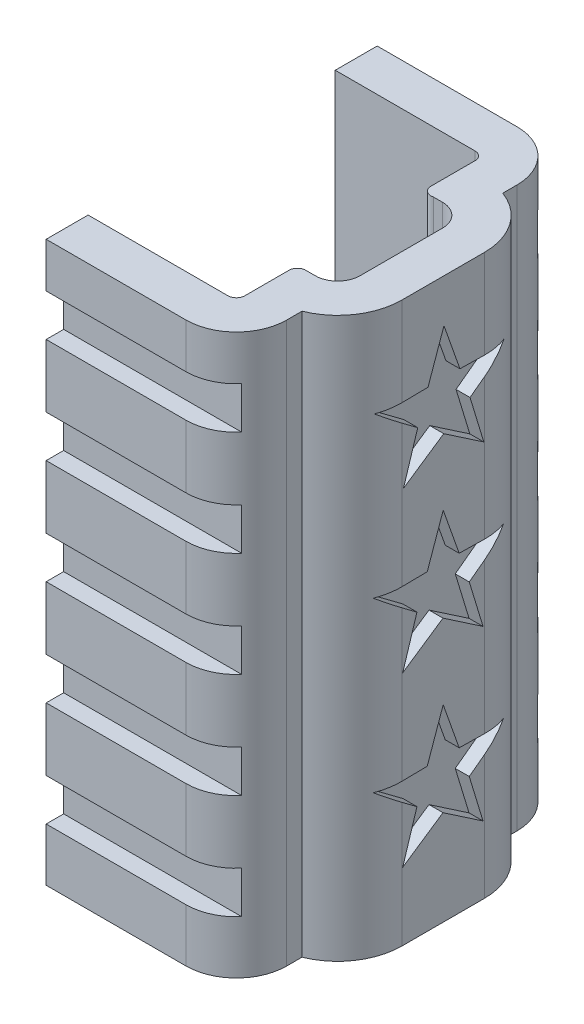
SolidWorks part; units mm, degrees
ref_plane "Front Plane" through (0, 0, 0) normal (0, 0, 1) x (1, 0, 0)
ref_plane "Top Plane" through (0, 0, 0) normal (0, 1, 0) x (1, 0, 0)
ref_plane "Right Plane" through (0, 0, 0) normal (1, 0, 0) x (0, 0, -1)
sketch "Sketch1" plane through (0, 0, 0) normal (0, 1, 0) x (1, 0, 0)
  line L0 (-69.609, 11.4133) -> (-56.909, 11.4133)
  line L1 (-56.147, 10.6513) -> (-56.147, 6.6372)
  line L2 (-55.183, 5.9024) -> (-54.3544, 5.9024)
  line L3 (-52.3224, 3.8704) -> (-52.3224, -3.6226)
  line L4 (-54.3544, -5.6546) -> (-55.218, -5.6546)
  line L5 (-55.98, -6.4166) -> (-55.98, -10.4307)
  line L6 (-56.742, -11.1927) -> (-69.442, -11.1927)
  line L7 (-69.609, 15.2233) -> (-56.909, 15.2233)
  line L8 (-52.337, 10.6513) -> (-52.337, 9.3531)
  line L9 (-52.337, 9.3531) -> (-52.337, 9.3531)
  line L10 (-48.5124, 3.8704) -> (-48.5124, -3.6226)
  line L11 (-52.17, -9.0408) -> (-52.17, -9.0408)
  line L12 (-52.17, -9.0408) -> (-52.17, -10.4307)
  line L13 (-56.742, -15.0027) -> (-69.442, -15.0027)
  line L14 (-69.609, 15.2233) -> (-69.609, 11.4133)
  line L15 (-69.442, -11.1927) -> (-69.442, -15.0027)
  arc A0 (-56.909, 11.4133) -> (-56.147, 10.6513) centre (-56.909, 10.6513) cw
  arc A1 (-56.147, 6.6372) -> (-55.183, 5.9024) centre (-55.385, 6.6372) ccw
  arc A2 (-54.3544, 5.9024) -> (-52.3224, 3.8704) centre (-54.3544, 3.8704) cw
  arc A3 (-52.3224, -3.6226) -> (-54.3544, -5.6546) centre (-54.3544, -3.6226) cw
  arc A4 (-55.218, -5.6546) -> (-55.98, -6.4166) centre (-55.218, -6.4166) ccw
  arc A5 (-55.98, -10.4307) -> (-56.742, -11.1927) centre (-56.742, -10.4307) cw
  arc A6 (-56.909, 15.2233) -> (-52.337, 10.6513) centre (-56.909, 10.6513) cw
  arc A7 (-52.337, 9.3531) -> (-52.337, 9.3531) centre (-52.337, 9.3531) ccw
  arc A8 (-52.337, 9.3531) -> (-48.5124, 3.8704) centre (-54.3544, 3.8704) cw
  arc A9 (-48.5124, -3.6226) -> (-52.17, -9.0408) centre (-54.3544, -3.6226) cw
  arc A10 (-52.17, -9.0408) -> (-52.17, -9.0408) centre (-52.17, -9.0408) ccw
  arc A11 (-52.17, -10.4307) -> (-56.742, -15.0027) centre (-56.742, -10.4307) cw
  dimension "D4" = 0.762
  dimension "D5" = 3.81
  dimension "D7" = 2.032
  dimension "D8" = 0.762
  dimension "D1" = 11.557
  dimension "D2" = 22.606
  dimension "D3" = 12.7
extrude "Boss-Extrude1" add sketch "Sketch1" along normal blind 50.8
ref_plane "Plane1" through (0, 0, -0.1103) normal (0, 0, -1) x (-1, 0, 0)
sketch "Sketch5" plane through (0, 0, 15.0027) normal (0, 0, 1) x (1, 0, 0)
  line L0 (-71.7998, 44.8264) -> (-50.0279, 44.8264) construction
  line L1 (-71.7998, 46.7314) -> (-50.0279, 46.7314)
  line L2 (-71.7998, 42.9214) -> (-50.0279, 42.9214)
  line L3 (-71.7998, 35.3014) -> (-50.0279, 35.3014) construction
  line L4 (-71.7998, 37.2064) -> (-50.0279, 37.2064)
  line L5 (-71.7998, 33.3964) -> (-50.0279, 33.3964)
  line L6 (-71.7998, 25.7764) -> (-50.0279, 25.7764) construction
  line L7 (-71.7998, 27.6814) -> (-50.0279, 27.6814)
  line L8 (-71.7998, 23.8714) -> (-50.0279, 23.8714)
  line L9 (-71.7998, 16.2514) -> (-50.0279, 16.2514) construction
  line L10 (-71.7998, 18.1564) -> (-50.0279, 18.1564)
  line L11 (-71.7998, 14.3464) -> (-50.0279, 14.3464)
  line L12 (-71.7998, 6.7264) -> (-50.0279, 6.7264) construction
  line L13 (-71.7998, 8.6314) -> (-50.0279, 8.6314)
  line L14 (-71.7998, 4.8214) -> (-50.0279, 4.8214)
  arc A0 (-71.7998, 46.7314) -> (-71.7998, 42.9214) centre (-71.7998, 44.8264) ccw
  arc A1 (-50.0279, 42.9214) -> (-50.0279, 46.7314) centre (-50.0279, 44.8264) ccw
  arc A2 (-71.7998, 37.2064) -> (-71.7998, 33.3964) centre (-71.7998, 35.3014) ccw
  arc A3 (-50.0279, 33.3964) -> (-50.0279, 37.2064) centre (-50.0279, 35.3014) ccw
  arc A4 (-71.7998, 27.6814) -> (-71.7998, 23.8714) centre (-71.7998, 25.7764) ccw
  arc A5 (-50.0279, 23.8714) -> (-50.0279, 27.6814) centre (-50.0279, 25.7764) ccw
  arc A6 (-71.7998, 18.1564) -> (-71.7998, 14.3464) centre (-71.7998, 16.2514) ccw
  arc A7 (-50.0279, 14.3464) -> (-50.0279, 18.1564) centre (-50.0279, 16.2514) ccw
  arc A8 (-71.7998, 8.6314) -> (-71.7998, 4.8214) centre (-71.7998, 6.7264) ccw
  arc A9 (-50.0279, 4.8214) -> (-50.0279, 8.6314) centre (-50.0279, 6.7264) ccw
  point P2 (-60.9139, 44.8264)
  point P7 (-60.9139, 35.3014)
  point P14 (-60.9139, 25.7764)
  point P21 (-60.9139, 16.2514)
  point P28 (-60.9139, 6.7264)
extrude "Cut-Extrude1" cut sketch "Sketch5" against normal blind 1.5875
mirror "Mirror1" about plane through (0, 0, -0.1103) normal (0, 0, -1) of "Cut-Extrude1"
sketch "Sketch6" plane through (-48.5124, 0, 0) normal (1, 0, 0) x (0, 0, -1)
  line L0 (0.1888, 46.8708) -> (1.641, 42.7573)
  line L1 (1.641, 42.7573) -> (6.095, 42.6759)
  line L2 (6.095, 42.6759) -> (2.5548, 40.0462)
  line L3 (2.5548, 40.0462) -> (3.807, 35.9206)
  line L4 (3.807, 35.9206) -> (0.1686, 38.3916)
  line L5 (0.1686, 38.3916) -> (-3.4872, 35.9206)
  line L6 (-3.4872, 35.9206) -> (-2.192, 40.0462)
  line L7 (-2.192, 40.0462) -> (-5.7348, 42.6952)
  line L8 (-5.7348, 42.6952) -> (-1.2603, 42.7573)
  line L9 (-1.2603, 42.7573) -> (0.1888, 46.8708)
  line L10 (0.1196, 32.3992) -> (1.5718, 28.2858)
  line L11 (1.5718, 28.2858) -> (6.0259, 28.2044)
  line L12 (6.0259, 28.2044) -> (2.4856, 25.5747)
  line L13 (2.4856, 25.5747) -> (3.7379, 21.4491)
  line L14 (3.7379, 21.4491) -> (0.0994, 23.9201)
  line L15 (0.0994, 23.9201) -> (-3.5564, 21.4491)
  line L16 (-3.5564, 21.4491) -> (-2.2612, 25.5747)
  line L17 (-2.2612, 25.5747) -> (-5.804, 28.2236)
  line L18 (-5.804, 28.2236) -> (-1.3295, 28.2858)
  line L19 (-1.3295, 28.2858) -> (0.1196, 32.3992)
  line L20 (0.1179, 17.1028) -> (1.5702, 12.9894)
  line L21 (1.5702, 12.9894) -> (6.0242, 12.9079)
  line L22 (6.0242, 12.9079) -> (2.4839, 10.2782)
  line L23 (2.4839, 10.2782) -> (3.7362, 6.1527)
  line L24 (3.7362, 6.1527) -> (0.0977, 8.6237)
  line L25 (0.0977, 8.6237) -> (-3.5581, 6.1527)
  line L26 (-3.5581, 6.1527) -> (-2.2628, 10.2782)
  line L27 (-2.2628, 10.2782) -> (-5.8057, 12.9272)
  line L28 (-5.8057, 12.9272) -> (-1.3312, 12.9894)
  line L29 (-1.3312, 12.9894) -> (0.1179, 17.1028)
extrude "Cut-Extrude2" cut sketch "Sketch6" against normal blind 1.27
